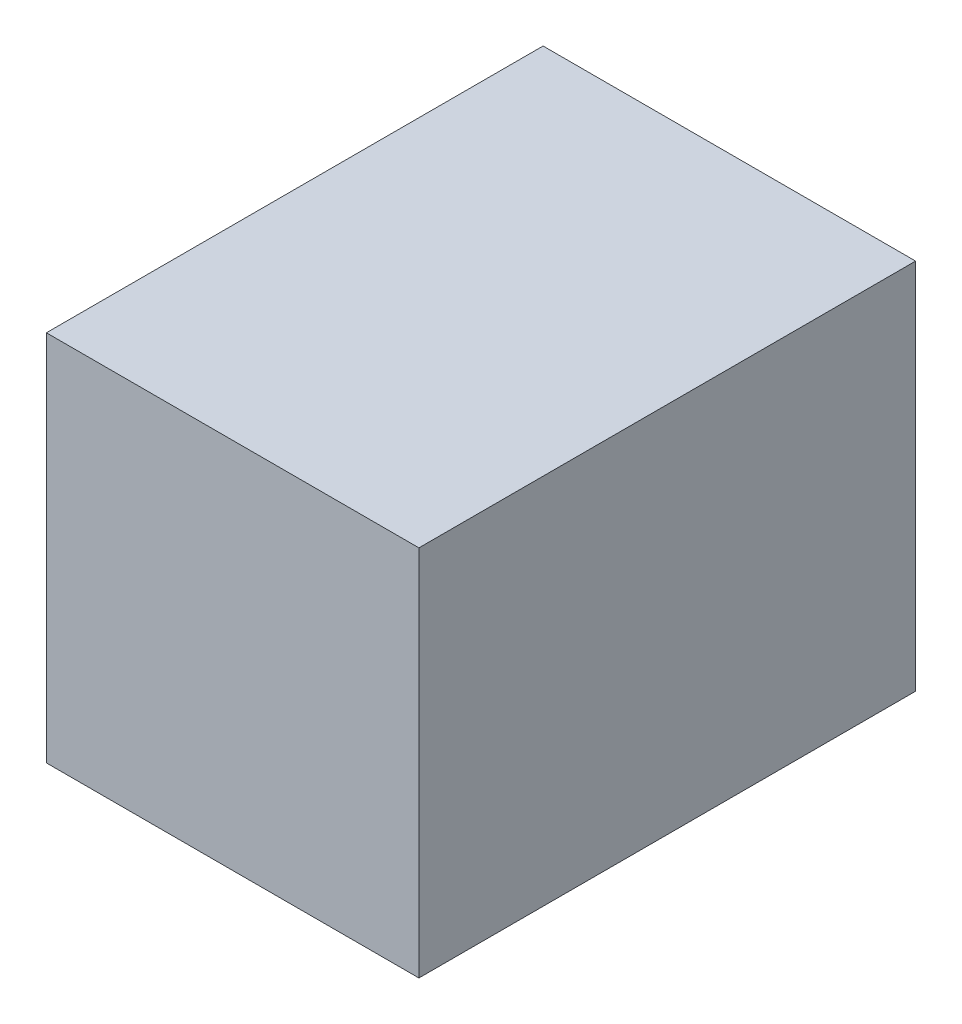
SolidWorks part; units mm, degrees
ref_plane "Front Plane" through (0, 0, 0) normal (0, 0, 1) x (1, 0, 0)
ref_plane "Top Plane" through (0, 0, 0) normal (0, 1, 0) x (1, 0, 0)
ref_plane "Right Plane" through (0, 0, 0) normal (1, 0, 0) x (0, 0, -1)
sketch "Sketch1" plane through (0, 0, 0) normal (0, 0, 1) x (1, 0, 0)
  line L1 (-150, 150) -> (150, 150)
  line L2 (-150, 150) -> (-150, -150)
  line L3 (-150, -150) -> (150, -150)
  line L4 (150, 150) -> (150, -150)
  line L5 (-150, 150) -> (150, -150) construction
  line L6 (-150, -150) -> (150, 150) construction
  point P0 (0, 0)
  dimension "D1" = 300
  dimension "D2" = 300
extrude "Boss-Extrude1" add sketch "Sketch1" along normal blind 300 and the other way blind 100
shell "Shell1" thickness 5
